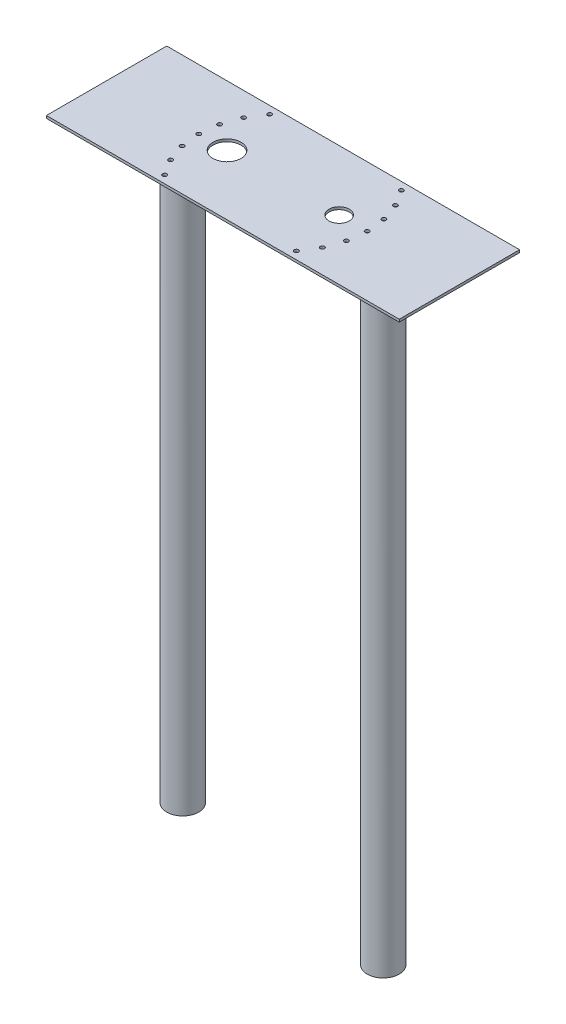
SolidWorks part; units mm, degrees
ref_plane "Alzado" through (0, 0, 0) normal (0, 0, 1) x (1, 0, 0)
ref_plane "Planta" through (0, 0, 0) normal (0, 1, 0) x (1, 0, 0)
ref_plane "Vista lateral" through (0, 0, 0) normal (1, 0, 0) x (0, 0, -1)
sketch "Croquis3" plane through (0, 0, 0) normal (0, 1, 0) x (1, 0, 0)
  line L0 (0, 0) -> (879.9, 0)
  line L1 (879.9, 0) -> (879.9, 300.1)
  line L2 (879.9, 300.1) -> (0, 300.1)
  line L3 (0, 300.1) -> (0, 0)
  dimension "D1" = 300.1
  dimension "D2" = 879.9
extrude "Saliente-Extruir1" add sketch "Croquis3" along normal blind 6.4
sketch "Croquis4" plane through (0, 6.4, 0) normal (0, 1, 0) x (1, 0, 0)
  line L0 (0, 300.1) -> (0, 0) construction
  line L1 (879.9, 0) -> (879.9, 300.1) construction
  line L3 (0, 0) -> (879.9, 0) construction
  circle A4 centre (300.4, 150) radius 35
  circle A6 centre (580, 150) radius 25.4
  dimension "D10" = 70
  dimension "D12" = 50.8
  dimension "D14" = 300.4
  dimension "D15" = 299.9
  dimension "D16" = 150
  dimension "D18" = 150
extrude "Cortar-Extruir1" cut sketch "Croquis4" against normal blind 6.4
sketch "Croquis9" plane through (0, 6.4, 0) normal (0, 1, 0) x (1, 0, 0)
  line L0 (879.9, 300.1) -> (0, 300.1) construction
  line L1 (0, 300.1) -> (0, 0) construction
  circle A0 centre (229.95, 150.05) radius 5.25
  dimension "D3" = 10.5
  dimension "D1" = 229.95
  dimension "D2" = 150.05
extrude "Cortar-Extruir3" cut sketch "Croquis9" against normal blind 10
pattern_circular "DESC_ASEGURA_COND" count 28 over 360 about axis through (439.95, 0, -150.05) along (0, 1, 0) of "Cortar-Extruir3"
sketch "Croquis10" plane through (0, 0, 0) normal (0, -1, 0) x (1, 0, 0)
  line L0 (0, -300.1) -> (0, 0) construction
  line L1 (879.9, 0) -> (879.9, -300.1) construction
  line L2 (0, 0) -> (879.9, 0) construction
  circle A4 centre (739.9, -100) radius 40
  circle A5 centre (140, -200) radius 40
  dimension "D14" = 80
  dimension "D10" = 200
  dimension "D11" = 140
  dimension "D12" = 140
  dimension "D13" = 100
extrude "PATAS_BASE_CONDENS" add sketch "Croquis10" along normal blind 1508
